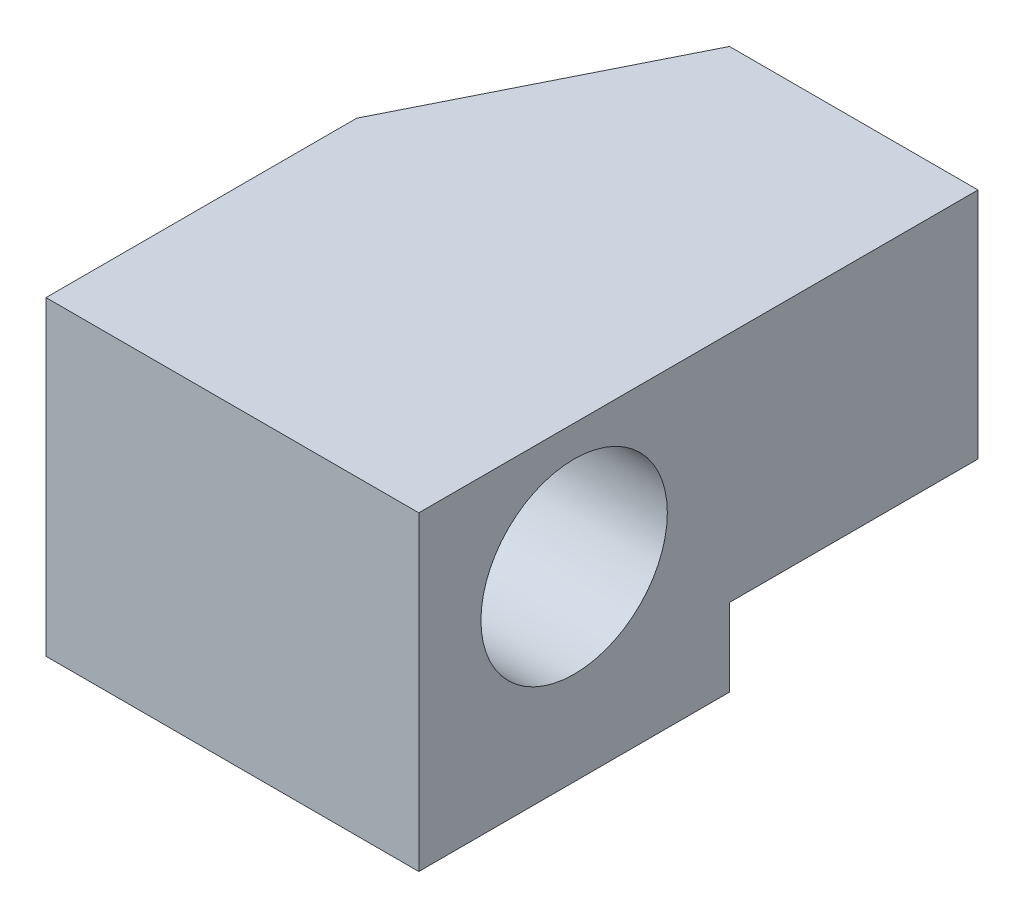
SolidWorks part; units mm, degrees
ref_plane "Front Plane" through (0, 0, 0) normal (0, 0, 1) x (1, 0, 0)
ref_plane "Top Plane" through (0, 0, 0) normal (0, 1, 0) x (1, 0, 0)
ref_plane "Right Plane" through (0, 0, 0) normal (1, 0, 0) x (0, 0, -1)
sketch "Skica1" plane through (0, 0, 0) normal (0, 0, 1) x (1, 0, 0)
  line L0 (60, 50) -> (-60, -50) construction
  line L1 (-60, 50) -> (60, 50)
  line L2 (-60, 50) -> (-60, -50)
  line L3 (-60, -50) -> (60, -50)
  line L4 (60, 50) -> (60, -50)
  dimension "D1" = 100
  dimension "D2" = 120
extrude "Vysunout1" add sketch "Skica1" along normal blind 100
sketch "Skica2" plane through (0, 50, 0) normal (0, 1, 0) x (1, 0, 0)
  line L0 (-60, 0) -> (-20, 80)
  line L1 (-20, 80) -> (60, 80)
  line L2 (60, 80) -> (60, 0)
  line L3 (60, 0) -> (-60, 0)
  dimension "D1" = 80
  dimension "D2" = 80
extrude "Vysunout2" add sketch "Skica2" against normal blind 75
sketch "Skica3" plane through (-60, 0, 0) normal (-1, 0, 0) x (0, 0, 1)
  line L0 (100, 50) -> (100, -50) construction
  line L1 (100, 50) -> (0, 50) construction
  circle A0 centre (50, 10) radius 30
  dimension "D1" = 60
  dimension "D2" = 50
  dimension "D3" = 40
extrude "Vysunout3" cut sketch "Skica3" against normal up to next
